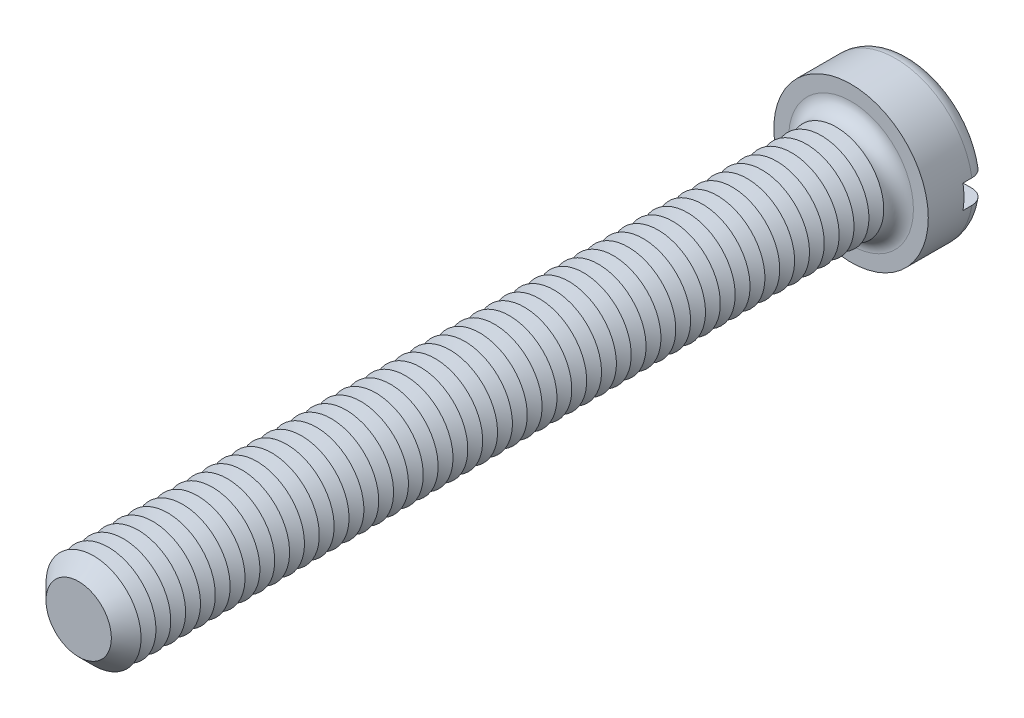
SolidWorks part; units mm, degrees
ref_plane "Front Plane" through (0, 0, 0) normal (0, 0, 1) x (1, 0, 0)
ref_plane "Top Plane" through (0, 0, 0) normal (0, 1, 0) x (1, 0, 0)
ref_plane "Right Plane" through (0, 0, 0) normal (1, 0, 0) x (0, 0, -1)
sketch "Sketch3" plane through (0, 0, 0) normal (0, 0, 1) x (1, 0, 0)
  circle A0 centre (0, 0) radius 6.5
  dimension "D1" = 13
extrude "Boss-Extrude2" add sketch "Sketch3" against normal blind 5
sketch "Sketch4" plane through (0, 0, 0) normal (0, 0, 1) x (1, 0, 0)
  circle A0 centre (0, 0) radius 4
  dimension "D1" = 8
extrude "Boss-Extrude3" add sketch "Sketch4" along normal blind 65
fillet "Fillet1" radius 1.25 2 edges at (6.5, 0, -5) (4, 0, 0)
chamfer "Chamfer1" distance 1.25 angle 45 1 edges at (4, 0, 65)
sketch "Sketch5" plane through (0, 0, 0) normal (1, 0, 0) x (0, 0, -1)
  line L0 (1.6944, 0) -> (-7.6738, 0) construction
sketch "Sketch6" plane through (0, 0, 0) normal (1, 0, 0) x (0, 0, -1)
  line L0 (-1.25, 4) -> (-1.875, 2.9175)
  line L1 (-1.875, 2.9175) -> (-2.5, 4)
  line L2 (-1.25, 4) -> (-63.75, 4) construction
  line L3 (-2.5, 4) -> (-1.25, 4)
  dimension "D1" = 1.25
revolve "Cut-Revolve1" cut sketch "Sketch6" angle 360 about L0
pattern_linear "LPattern1" count 50 spacing 1.25 along (0, 0, 1) of "Cut-Revolve1"
sketch "Sketch8" plane through (0, 0, -5) normal (0, 0, -1) x (-1, 0, 0)
  line L1 (6.5, -1) -> (-6.5, -1)
  line L2 (6.5, -1) -> (6.5, 1)
  line L3 (6.5, 1) -> (-6.5, 1)
  line L4 (-6.5, -1) -> (-6.5, 1)
  line L5 (6.5, -1) -> (-6.5, 1) construction
  line L6 (6.5, 1) -> (-6.5, -1) construction
  point P0 (0, 0)
  dimension "D1" = 13
  dimension "D2" = 2
extrude "Cut-Extrude1" cut sketch "Sketch8" against normal blind 2
